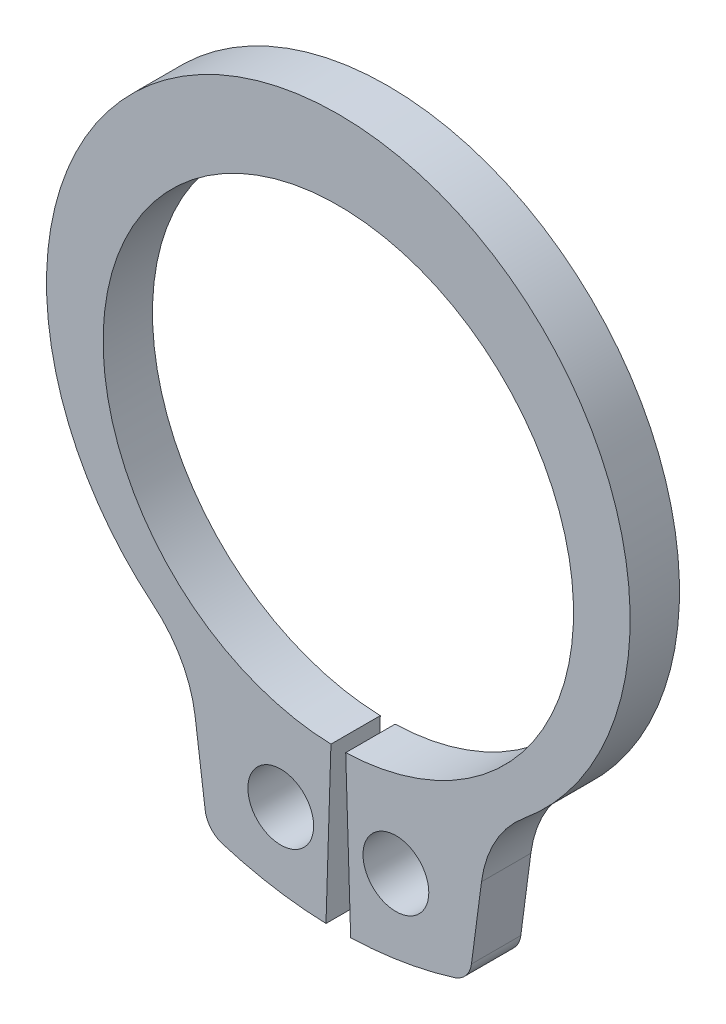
SolidWorks part; units mm, degrees
ref_plane "Plane1" through (0, 0, 0) normal (0, 0, 1) x (1, 0, 0)
ref_plane "Plane2" through (0, 0, 0) normal (0, 1, 0) x (1, 0, 0)
ref_plane "Plane3" through (0, 0, 0) normal (1, 0, 0) x (0, 0, -1)
sketch "Clipboard" plane through (0, 0, 0) normal (0, 0, 1) x (1, 0, 0)
  line L0 (0, 0) -> (2.4, 0)
  line L1 (0, 0) -> (0, 1.2)
  line L2 (0, 0) -> (0, -4.8)
  circle A0 centre (0, 0) radius 1
  circle A1 centre (0, 0) radius 7.5
  dimension "HoleDia" = 2
  dimension "ShaftDia" = 15
  dimension "LargeSection" = 2.4
  dimension "SmallSection" = 1.2
  dimension "LugSection" = 4.8
sketch "BodySke" plane through (0, 0, 0) normal (0, 0, 1) x (1, 0, 0)
  line L0 (-1.5431, 0) -> (1.5431, 0) construction
  line L1 (0, 0) -> (0, 9.55) construction
  line L2 (0.2244, -7.1465) -> (0.375, -11.9441)
  line L3 (-0.2244, -7.1465) -> (-0.375, -11.9441)
  line L4 (0, 0) -> (7.918, -8.9503) construction
  line L5 (0, 0) -> (-7.918, -8.9503) construction
  line L7 (4.3521, -8.4808) -> (4.0468, -10.7997)
  line L8 (-4.3521, -8.4808) -> (-4.0468, -10.7997)
  circle A0 centre (0, 0) radius 7.15 construction
  arc A1 (0.2244, -7.1465) -> (-0.2244, -7.1465) centre (0, 0) ccw
  arc A2 (5.5327, -6.254) -> (-5.5327, -6.254) centre (0, 0.6796) ccw construction
  arc A3 (0.375, -11.9441) -> (3.5244, -11.4185) centre (0, 0) ccw
  arc A4 (5.6337, -6.1721) -> (4.3521, -8.4808) centre (7.918, -8.9503) ccw
  arc A5 (-4.3521, -8.4808) -> (-5.6337, -6.1721) centre (-7.918, -8.9503) ccw
  arc A6 (-3.5244, -11.4185) -> (-0.375, -11.9441) centre (0, 0) ccw
  arc A7 (5.6337, -6.1721) -> (-5.6337, -6.1721) centre (0, 0.6796) ccw
  arc A8 (-4.3216, -8.712) -> (4.3216, -8.712) centre (0, 0) ccw construction
  circle A9 centre (1.75, -9.5662) radius 1
  circle A10 centre (-1.75, -9.5662) radius 1
  arc A11 (4.0468, -10.7997) -> (3.5244, -11.4185) centre (3.3032, -10.7018) cw
  arc A12 (-4.0468, -10.7997) -> (-3.5244, -11.4185) centre (-3.3032, -10.7018) ccw
  point P28 (3.9854, -11.2658)
  point P31 (-3.9854, -11.2658)
  dimension "GrooveDia" = 14.3
  dimension "D3" = 0.75
  dimension "LugRad" = 11.95
  dimension "HoleOffsetRad" = 9.725
  dimension "HoleDia" = 2
  dimension "D2" = 15
  dimension "LargeRad" = 9.55
  dimension "SmallRad" = 8.35
  dimension "Gap" = 0.75
  dimension "SmallAngle" = 82.996
  dimension "HoleSpacing" = 3.5
extrude "Body" add sketch "BodySke" against normal blind 1.5
sketch "NotSke" plane through (0, 0, 0) normal (0, 0, 1) x (1, 0, 0)
  line L0 (1.75, -8.5662) -> (1.75, -10.5662)
  line L1 (1.75, -10.5662) -> (-1.75, -10.5662)
  line L2 (-1.75, -10.5662) -> (-1.75, -8.5662)
  line L3 (-1.75, -8.5662) -> (1.75, -8.5662)
  circle A0 centre (1.75, -9.5662) radius 1 construction
  circle A1 centre (-1.75, -9.5662) radius 1 construction
extrude "Notch" [suppressed] cut sketch "NotSke" against normal through all
sketch "UnlSke" plane through (0, 0, 0) normal (0, 0, 1) x (1, 0, 0)
  line L0 (-3.3477, -11.4715) -> (-2.003, -6.8637)
  line L1 (3.3477, -11.4715) -> (2.003, -6.8637)
  arc A0 (2.003, -6.8637) -> (-2.003, -6.8637) centre (0, 0) ccw
  arc A1 (3.3477, -11.4715) -> (-3.3477, -11.4715) centre (0, 0) ccw
  arc A2 (0.375, -11.9441) -> (3.5244, -11.4185) centre (0, 0) ccw construction
  arc A3 (0.2244, -7.1465) -> (-0.2244, -7.1465) centre (0, 0) ccw construction
  circle A4 centre (-1.75, -9.5662) radius 1 construction
  circle A5 centre (1.75, -9.5662) radius 1 construction
extrude "Unlug" [suppressed] add sketch "UnlSke" against normal through all
equation "' \"ShaftDia@Clipboard\" = 15"
equation "' \"Thickness@Body\" = 1.5"
equation "' \"GrooveDia@BodySke\" = 14.3"
equation "' \"LugSection@Clipboard\" = 4.8"
equation "' \"LargeSection@Clipboard\" = 2.4"
equation "' \"HoleDia@Clipboard\" = 2.0"
equation "' \"ShaftDia@Clipboard\" = 50"
equation "' \"Thickness@Body\" = 3"
equation "' \"GrooveDia@BodySke\" = 47"
equation "' \"LugSection@Clipboard\" = 8"
equation "' \"LargeSection@Clipboard\" = 5.1"
equation "' \"HoleDia@Clipboard\" = 2.5"
equation "\"SmallSection@Clipboard\" = \"LargeSection@Clipboard\" * 0.5"
equation "\"Gap@BodySke\" =  \"Thickness@Body\" / 2"
equation "\"LargeRad@BodySke\" =  \"GrooveDia@BodySke\" / 2 +  \"LargeSection@Clipboard\""
equation "\"SmallRad@BodySke\" =  \"GrooveDia@BodySke\" / 2 +  \"SmallSection@Clipboard\""
equation "\"LugRad@BodySke\" = \"GrooveDia@BodySke\" / 2 + \"LugSection@Clipboard\""
equation "\"HoleOffsetRad@BodySke\" = (  \"ShaftDia@Clipboard\" / 2 + \"LugRad@BodySke\" ) / 2"
equation "\"HoleSpacing@BodySke\" = \"Gap@BodySke\"  * 2 +  \"HoleDia@Clipboard\""
equation "\"HoleDia@BodySke\" =  \"HoleDia@Clipboard\""
equation "\"SmallAngle@BodySke\" = atn(\"HoleSpacing@BodySke\" / 2 / sqr(\"HoleOffsetRad@BodySke\"  * \"HoleOffsetRad@BodySke\" - (\"HoleSpacing@BodySke\" / 2) * (\"HoleSpacing@BodySke\" / 2) ))  * 7 *  (\"LargeRad@BodySke\""
